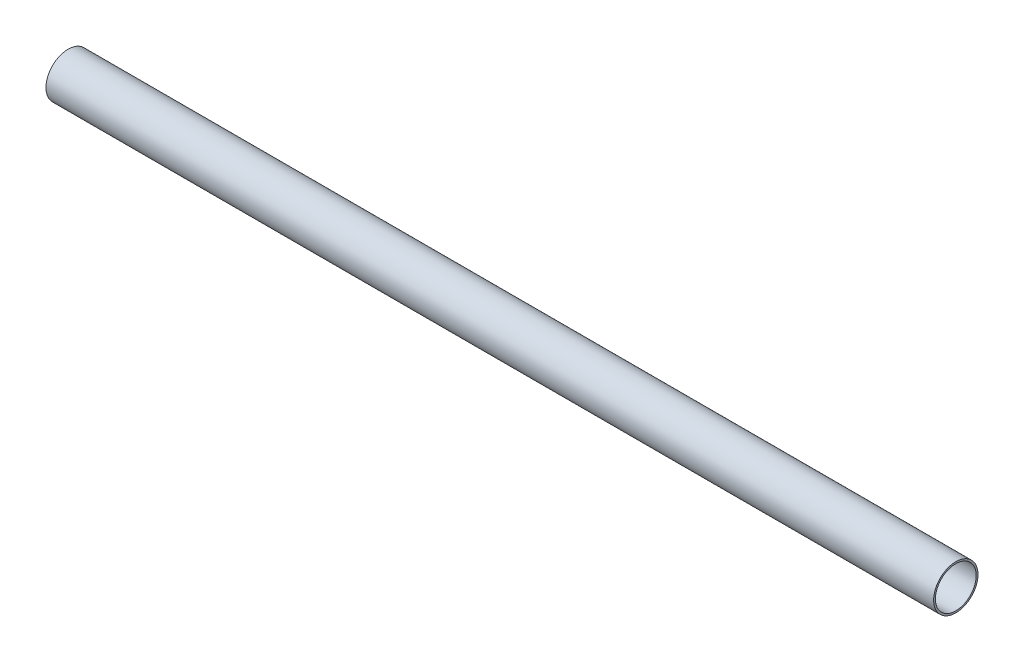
SolidWorks part; units mm, degrees
ref_plane "Front Plane" through (0, 0, 0) normal (0, 0, 1) x (1, 0, 0)
ref_plane "Top Plane" through (0, 0, 0) normal (0, 1, 0) x (1, 0, 0)
ref_plane "Right Plane" through (0, 0, 0) normal (1, 0, 0) x (0, 0, -1)
sketch3d "3DSketch1"
  line L0 (0, 0, 0) -> (1000, 0, 0)
  dimension "D1" = 1000
other "Kuljetinrullat 50x2 1.8075 KULJETINRULLA AL 50X2 ANODISOITU(1)"
ref_plane "Plane1" through (0, 0, 0) normal (1, 0, 0) x (0, 0, -1)
sketch "Sketch12" plane through (0, 0, 0) normal (1, 0, 0) x (0, 0, -1)
  circle A0 centre (0, 0) radius 25
  circle A1 centre (0, 0) radius 23
  point P4 (0, 0)
  dimension "D1" = 50
  dimension "D2" = 46
